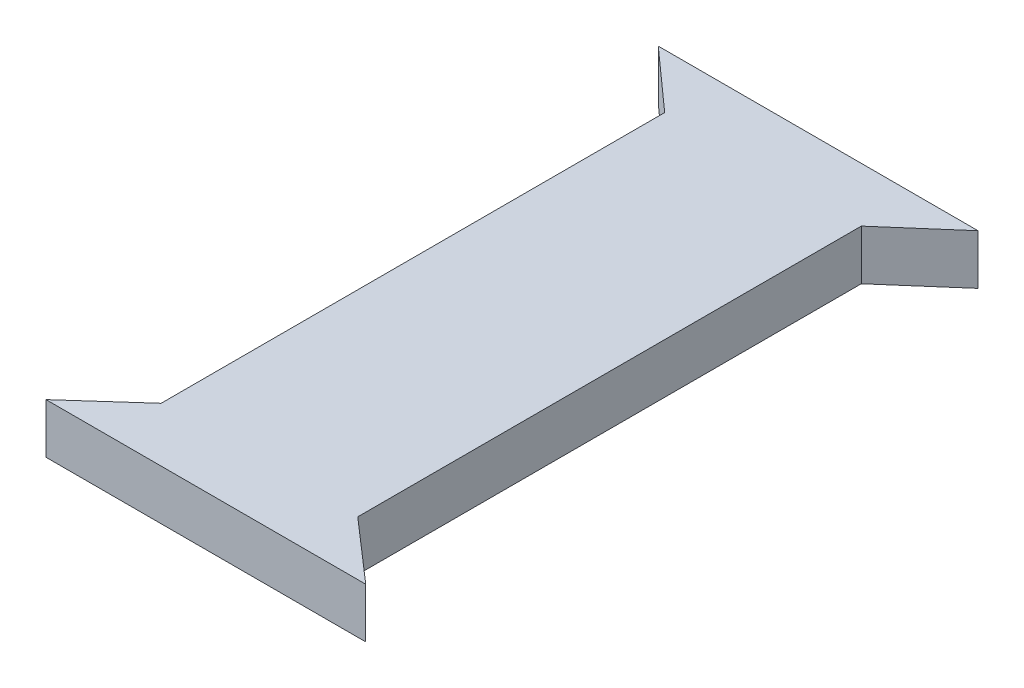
SolidWorks part; units mm, degrees
ref_plane "Front" through (0, 0, 0) normal (0, 0, 1) x (1, 0, 0)
ref_plane "Top" through (0, 0, 0) normal (0, 1, 0) x (1, 0, 0)
ref_plane "Right" through (0, 0, 0) normal (1, 0, 0) x (0, 0, -1)
sketch "Sketch1" plane through (0, 0, 0) normal (0, 1, 0) x (1, 0, 0)
  line L0 (-24.6, 63) -> (-39.8, 76.6)
  line L2 (-24.6, 63) -> (-24.6, -63)
  line L4 (24.6, 63) -> (24.6, -63)
  line L5 (-39.8, 76.6) -> (40.2, 76.6)
  line L6 (40.2, 76.6) -> (24.6, 63)
  line L7 (0, 92.6) -> (0, -97.8) construction
  line L8 (-91, 0) -> (88.6, 0) construction
  line L9 (40.2, -76.6) -> (24.6, -63)
  line L10 (-24.6, -63) -> (-39.8, -76.6)
  line L11 (-39.8, -76.6) -> (40.2, -76.6)
  point P0 (0, 0)
  dimension "D1" = 80
extrude "Boss-Extrude1" add sketch "Sketch1" along normal blind 12.5
